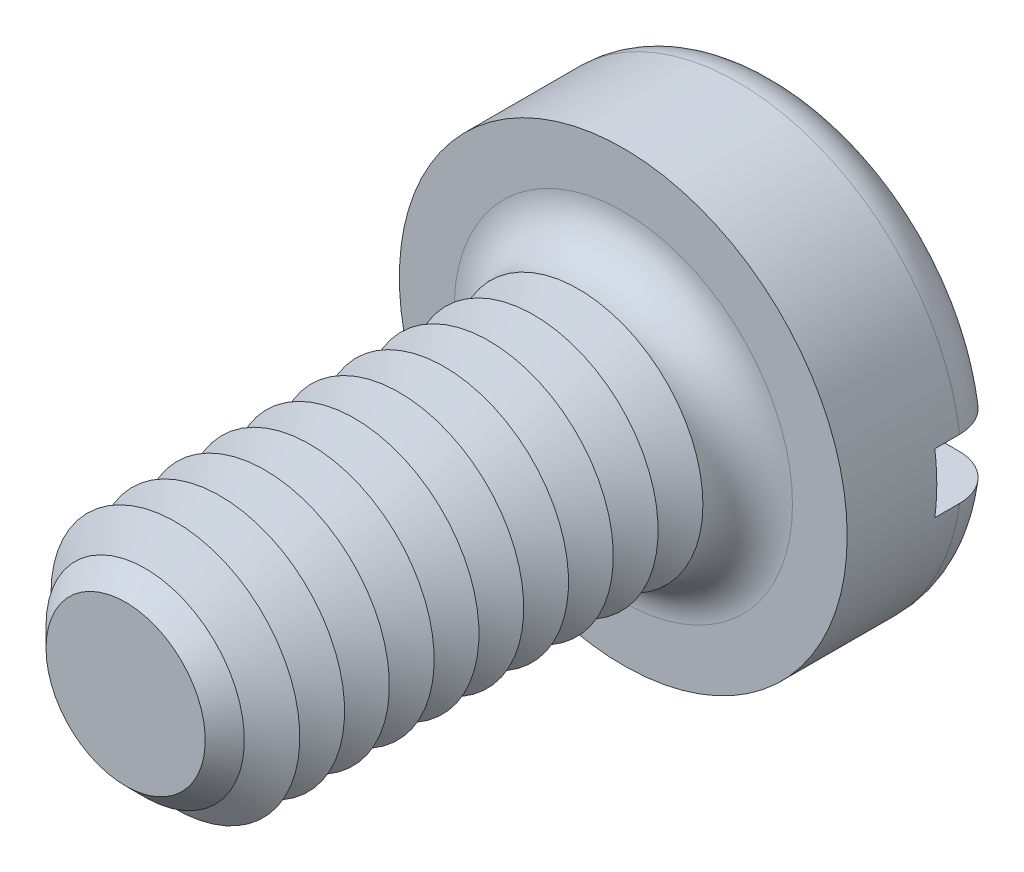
SolidWorks part; units mm, degrees
ref_plane "Front Plane" through (0, 0, 0) normal (0, 0, 1) x (1, 0, 0)
ref_plane "Top Plane" through (0, 0, 0) normal (0, 1, 0) x (1, 0, 0)
ref_plane "Right Plane" through (0, 0, 0) normal (1, 0, 0) x (0, 0, -1)
sketch "Sketch3" plane through (0, 0, 0) normal (0, 0, 1) x (1, 0, 0)
  circle A0 centre (0, 0) radius 2.25
  dimension "D1" = 4.5
extrude "Boss-Extrude2" add sketch "Sketch3" against normal blind 1.6
sketch "Sketch4" plane through (0, 0, 0) normal (0, 0, 1) x (1, 0, 0)
  circle A0 centre (0, 0) radius 1.25
  dimension "D1" = 2.5
extrude "Boss-Extrude3" add sketch "Sketch4" along normal blind 5
fillet "Fillet1" radius 0.45 2 edges at (2.25, 0, -1.6) (1.25, 0, 0)
chamfer "Chamfer1" distance 0.45 angle 45 1 edges at (1.25, 0, 5)
sketch "Sketch5" plane through (0, 0, 0) normal (1, 0, 0) x (0, 0, -1)
  line L0 (1.6944, 0) -> (-7.6738, 0) construction
sketch "Sketch6" plane through (0, 0, 0) normal (1, 0, 0) x (0, 0, -1)
  line L0 (-0.45, 1.25) -> (-0.675, 0.8603)
  line L1 (-0.675, 0.8603) -> (-0.9, 1.25)
  line L2 (-0.45, 1.25) -> (-4.55, 1.25) construction
  line L3 (-0.9, 1.25) -> (-0.45, 1.25)
  dimension "D1" = 0.45
revolve "Cut-Revolve1" cut sketch "Sketch6" angle 360 about L0
pattern_linear "LPattern1" count 10 spacing 0.45 along (0, 0, 1) of "Cut-Revolve1"
sketch "Sketch8" plane through (0, 0, -1.6) normal (0, 0, -1) x (-1, 0, 0)
  line L1 (2.25, -0.3) -> (-2.25, -0.3)
  line L2 (2.25, -0.3) -> (2.25, 0.3)
  line L3 (2.25, 0.3) -> (-2.25, 0.3)
  line L4 (-2.25, -0.3) -> (-2.25, 0.3)
  line L5 (2.25, -0.3) -> (-2.25, 0.3) construction
  line L6 (2.25, 0.3) -> (-2.25, -0.3) construction
  point P0 (0, 0)
  dimension "D1" = 4.5
  dimension "D2" = 0.6
extrude "Cut-Extrude1" cut sketch "Sketch8" against normal blind 0.7
